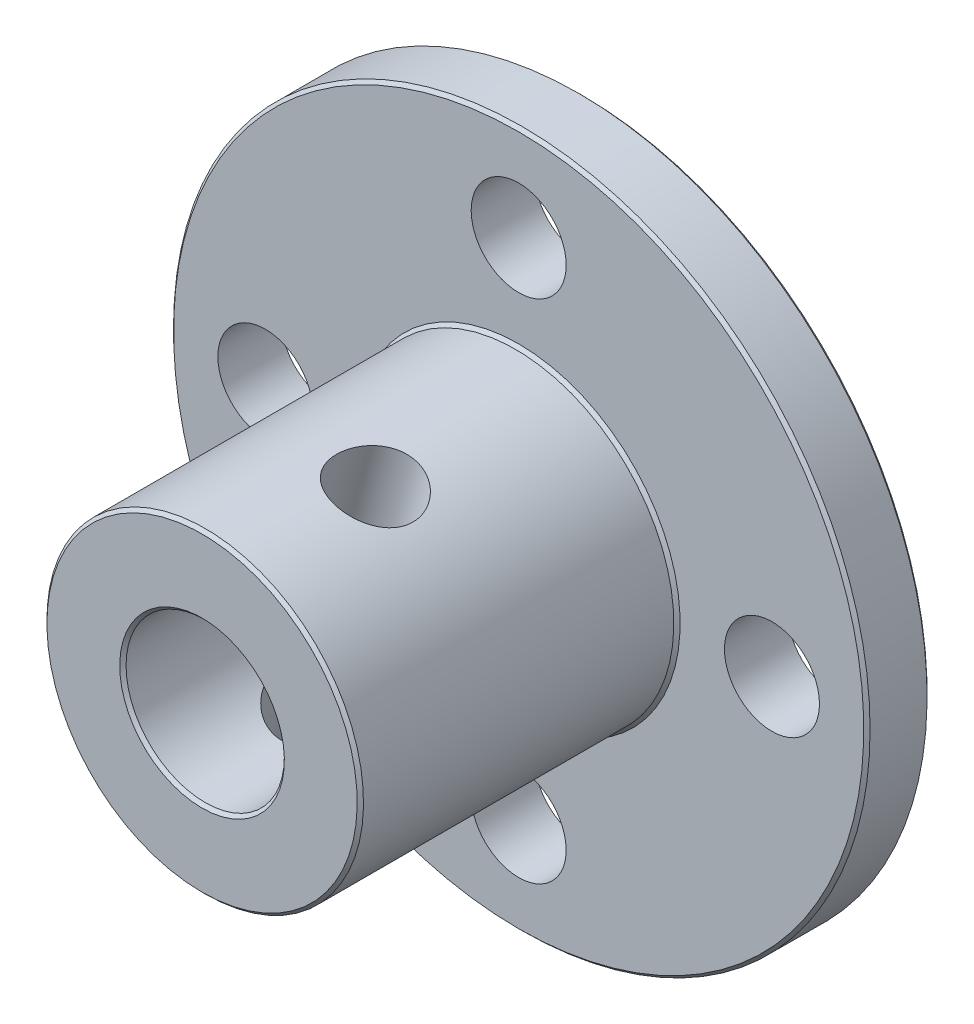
SolidWorks part; units mm, degrees
ref_plane "Front" through (0, 0, 0) normal (0, 0, 1) x (1, 0, 0)
ref_plane "Top" through (0, 0, 0) normal (0, 1, 0) x (1, 0, 0)
ref_plane "Right" through (0, 0, 0) normal (1, 0, 0) x (0, 0, -1)
sketch "Sketch1" plane through (0, 0, 0) normal (1, 0, 0) x (0, 0, -1)
  line L0 (0, 0) -> (-12, 0) construction
  line L1 (-12, 2.5) -> (0, 2.5)
  line L2 (0, 2.5) -> (0, 11)
  line L3 (0, 11) -> (-2, 11)
  line L4 (-2, 11) -> (-2, 5)
  line L5 (-2, 5) -> (-12, 5)
  line L6 (-12, 5) -> (-12, 2.5)
  dimension "D1" = 12
  dimension "bore" = 5
  dimension "D2" = 2
  dimension "D3" = 22
  dimension "D4" = 10
revolve "Revolve1" add sketch "Sketch1" angle 360 about L0
sketch "Sketch2" plane through (0, 0, 0) normal (0, 0, -1) x (-1, 0, 0)
  circle A3 centre (0, 8) radius 1.5
  circle A4 centre (0, 0) radius 8 construction
  dimension "D1" = 3
  dimension "D2" = 16
extrude "first mounting hole" cut sketch "Sketch2" against normal up to next
pattern_circular "mounting hole pattern" count 4 over 360 about axis through (0, 0, 0) along (0, 0, 1) of "first mounting hole"
ref_plane "setscrew bore plane" through (0, 0, 0) normal (0.2588, 0.9659, 0) x (0, 0, -1)
sketch "Sketch3" plane through (0, 0, 0) normal (0.2588, 0.9659, 0) x (0, 0, -1)
  line L0 (-2, 5) -> (-2, -5) construction
  circle A0 centre (-7.8, 0) radius 1.25
  dimension "D1" = 2.5
  dimension "D2" = 5.8
extrude "M3 setscrew bore" cut sketch "Sketch3" against normal through all both and the other way through all
chamfer "Chamfer1" distance 0.1 angle 45 6 edges at (0, 5, 12) (0, 2.5, 12) (0, 5, 2) (0, 11, 2) (0, 11, 0) (0, 2.5, 0)
